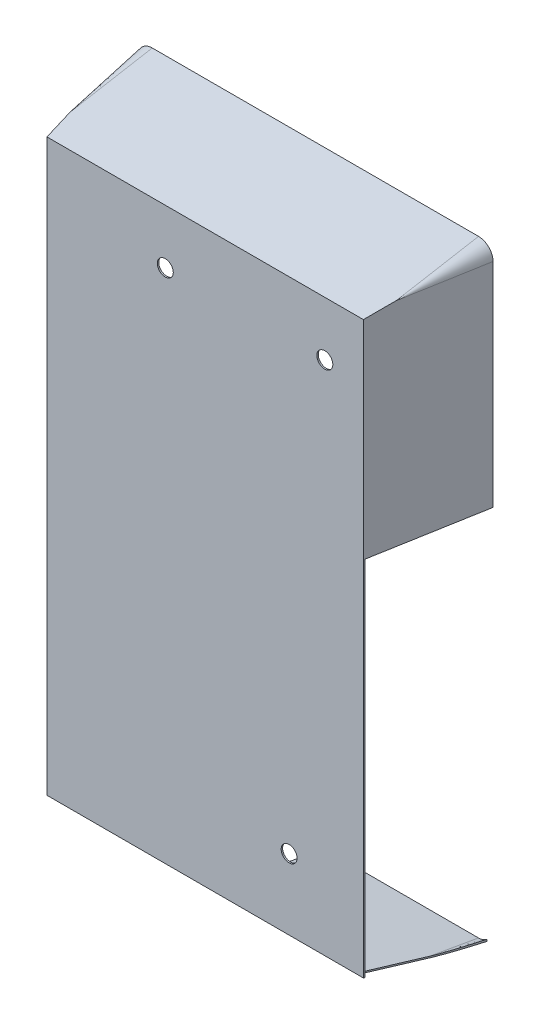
SolidWorks part; units mm, degrees
ref_plane "Plan de face" through (0, 0, 0) normal (0, 0, 1) x (1, 0, 0)
ref_plane "Plan de dessus" through (0, 0, 0) normal (0, 1, 0) x (1, 0, 0)
ref_plane "Plan de droite" through (0, 0, 0) normal (1, 0, 0) x (0, 0, -1)
sketch "Esquisse1" plane through (0, 0, 0) normal (0, 0, 1) x (1, 0, 0)
  line L1 (-30, 86.87) -> (195, 86.87)
  line L2 (-40, 76.87) -> (-40, -323.13)
  line L3 (-30, -333.13) -> (195, -333.13)
  line L4 (205, 76.87) -> (205, -323.13)
  arc A0 (205, 76.87) -> (195, 86.87) centre (195, 76.87) ccw
  arc A1 (-40, 76.87) -> (-30, 86.87) centre (-30, 76.87) cw
  arc A2 (-30, -333.13) -> (-40, -323.13) centre (-30, -323.13) cw
  arc A3 (205, -323.13) -> (195, -333.13) centre (195, -323.13) cw
  point P7 (205, 86.87)
  point P10 (-40, 86.87)
  point P13 (-40, -333.13)
  dimension "D3" = 10
  dimension "D1" = 245
  dimension "D2" = 420
  dimension "D4" = 205
  dimension "D5" = 86.87
extrude "Extrusion1" add sketch "Esquisse1" along normal blind 76 draft 10
shell "Coque1" thickness 1
sketch "Esquisse5" plane through (198.8185, 0, 35.0571) normal (0.9848, 0, 0.1736) x (0.1736, 0, -0.9848)
  line L0 (-40.7354, -318.89) -> (-40.7354, 72.63) construction
  line L1 (-40.7354, -70) -> (51.5017, -70)
  line L2 (-40.7354, -70) -> (-40.7354, -376.5343)
  line L3 (-40.7354, -376.5343) -> (51.5017, -376.5343)
  line L4 (51.5017, -70) -> (51.5017, -376.5343)
  dimension "D1" = 70
  dimension "D2" = 306.5343
extrude "Enlèv. mat.-Extru.4" cut sketch "Esquisse5" against normal blind 4
sketch "Esquisse7" plane through (0, -323.0849, 56.9686) normal (0, -0.9848, 0.1736) x (1, 0, 0)
  line L0 (-30, -57.8474) -> (195, -57.8474) construction
  line L1 (88.3302, -57.8474) -> (13.4009, -57.8474)
  line L2 (88.3302, -57.8474) -> (88.3302, 12.1526)
  line L3 (88.3302, 12.1526) -> (13.4009, 12.1526)
  line L4 (13.4009, -57.8474) -> (13.4009, 12.1526)
  dimension "D1" = 70
  dimension "D2" = 74.9294
  dimension "D3" = 40
extrude "Enlèv. mat.-Extru.8" cut sketch "Esquisse7" against normal blind 4
sketch "Esquisse8" plane through (0, 0, 0) normal (0, 0, 1) x (1, 0, 0)
  circle A0 centre (164.9999, 36.0682) radius 5.5
  circle A1 centre (55, 36.0682) radius 5.5
  circle A2 centre (140.3909, -271.0855) radius 5.5
  dimension "D1" = 11
  dimension "D2" = 11
  dimension "D3" = 11
  dimension "D4" = 109.9999
  dimension "D5" = 36.0682
  dimension "D6" = 55
  dimension "D7" = 307.1537
  dimension "D8" = 85.3909
extrude "Enlèv. mat.-Extru.9" cut sketch "Esquisse8" along normal blind 93.6808
